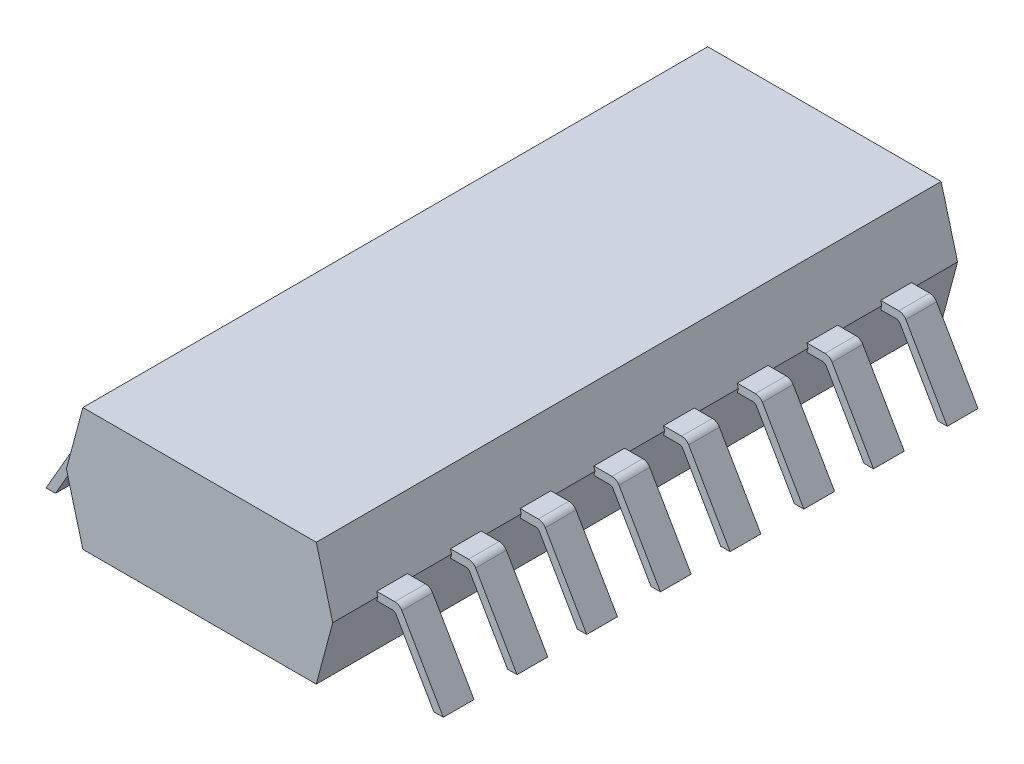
SolidWorks part; units mm, degrees
ref_plane "Front Plane" through (0, 0, 0) normal (0, 0, 1) x (1, 0, 0)
ref_plane "Top Plane" through (0, 0, 0) normal (0, 1, 0) x (1, 0, 0)
ref_plane "Right Plane" through (0, 0, 0) normal (1, 0, 0) x (0, 0, -1)
body saved out of another part "Stock-PSU-1"
pattern_linear "LPattern1" count 2 spacing 3.5 along (0, 0, 1)
combine bodies "Combine1" operation type add bodies to combine 102 101
pattern_linear "LPattern2" count 2 spacing 7 along (0, 0, 1)
combine bodies "Combine2" operation type add bodies to combine 104 103
